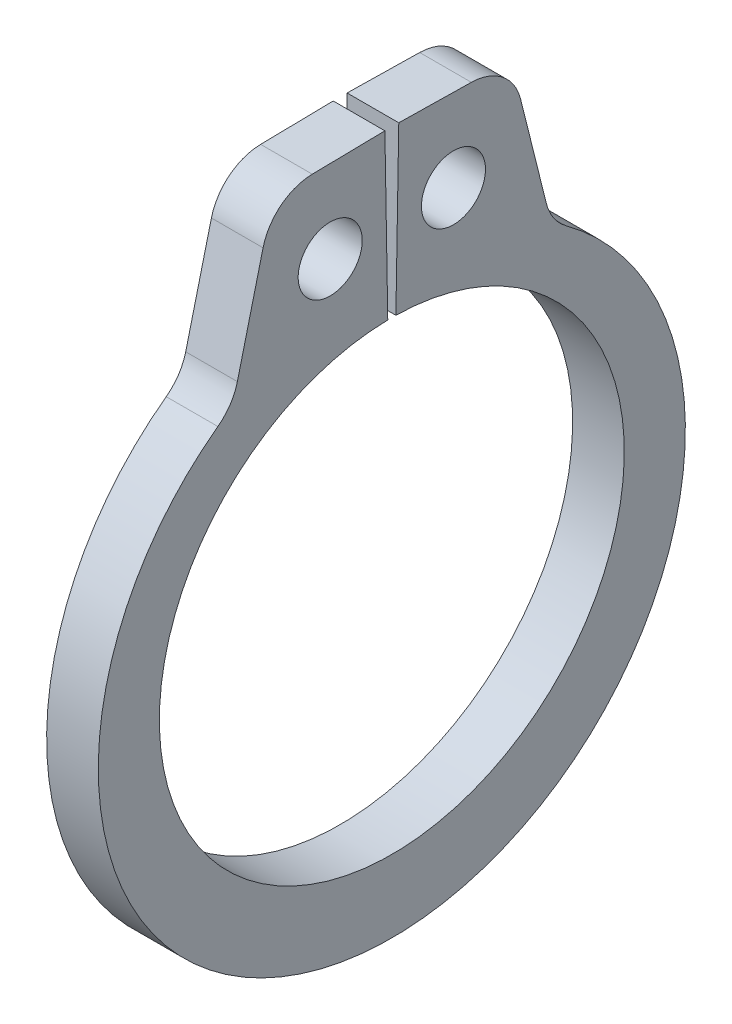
SolidWorks part; units mm, degrees
ref_plane "Front" through (0, 0, 0) normal (0, 0, 1) x (1, 0, 0)
ref_plane "Top" through (0, 0, 0) normal (0, 1, 0) x (1, 0, 0)
ref_plane "Right" through (0, 0, 0) normal (1, 0, 0) x (0, 0, -1)
sketch "Sketch1" plane through (0, 0, 0) normal (1, 0, 0) x (0, 0, -1)
  line L0 (0, 0) -> (0, 2.8575) construction
  line L1 (-0.0499, 2.8571) -> (-0.0853, 4.8888)
  line L2 (-0.0853, 4.8888) -> (-1.4649, 4.8647) construction
  line L3 (-1.4649, 4.8647) -> (-1.9565, 2.893) construction
  line L4 (0.0853, 4.8888) -> (0.0499, 2.8571)
  line L5 (0.0853, 4.8888) -> (1.4649, 4.8647) construction
  line L6 (1.4649, 4.8647) -> (1.9565, 2.893) construction
  line L7 (-1.9565, 2.893) -> (-1.6008, 2.367) construction
  line L8 (1.9565, 2.893) -> (1.6008, 2.367) construction
  line L9 (0, -2.8575) -> (0, -3.7465) construction
  line L10 (-1.4649, 4.8647) -> (-0.0499, 2.8571) construction
  line L11 (-2.8575, 0) -> (2.8575, 0) construction
  line L12 (0, 2.8575) -> (0, 4.8895) construction
  line L13 (1.4649, 4.8647) -> (1.9565, 2.893)
  line L14 (-1.4649, 4.8647) -> (-1.9565, 2.893)
  line L15 (0.0853, 4.8888) -> (1.4649, 4.8647)
  line L16 (-0.0853, 4.8888) -> (-1.4649, 4.8647)
  circle A0 centre (0, 0) radius 2.8575 construction
  arc A1 (-0.0499, 2.8571) -> (0.0499, 2.8571) centre (0, 0) ccw
  circle A2 centre (0, -0.1385) radius 3.608 construction
  circle A3 centre (0, 0) radius 4.699 construction
  circle A4 centre (-0.7574, 3.8609) radius 0.3937
  circle A5 centre (0.7574, 3.8609) radius 0.3937
  arc A6 (-1.9565, 2.893) -> (1.9565, 2.893) centre (0, -0.1385) ccw
  dimension "D1" = 15
  dimension "A" = 5.715
  dimension "L" = 9.398
  dimension "Hole" = 0.7874
  dimension "Smin" = 0.635
  dimension "Smax" = 0.889
  dimension "H" = 2.032
  dimension "Angle" = 1
extrude "Extrude1" add sketch "Sketch1" along normal mid plane 0.635
fillet "Fillet1" radius 0.635 4 edges at (0, 2.893, 1.9565) (0, 2.893, -1.9565) (0, 4.8647, -1.4649) (0, 4.8647, 1.4649)
sketch "Sketch2" plane through (0, 0, 0) normal (0, 0, 1) x (1, 0, 0)
  line L0 (-1.905, 0) -> (5.715, 0)
  line L1 (5.715, 0) -> (5.715, -3.175)
  line L3 (5.715, -3.175) -> (0.381, -3.175)
  line L4 (0.381, -3.175) -> (0.381, -2.921)
  line L5 (0.381, -2.921) -> (-0.381, -2.921)
  line L6 (-0.381, -2.921) -> (-0.381, -3.175)
  line L7 (-0.381, -3.175) -> (-1.905, -3.175) construction
  line L8 (-1.905, -3.175) -> (-1.905, 0) construction
  line L9 (0, -2.921) -> (0, 0) construction
  line L10 (5.715, 0) -> (14.0551, 0) construction
  line L11 (-0.381, -3.175) -> (-1.778, -3.175)
  line L12 (-1.778, -3.175) -> (-1.905, -3.048)
  line L13 (-1.905, -3.048) -> (-1.905, 0)
  point P14 (-0.381, -3.048)
revolve "Revolve1" [suppressed] add sketch "Sketch2" angle 360 about L10
equation "\"D2@Sketch2\" = \"W@Sketch2\"*10"
equation "\"D3@Sketch2\" = \"D2@Sketch2\"/4"
equation "\"D1@Fillet1\" = \"D1@Extrude1\""
